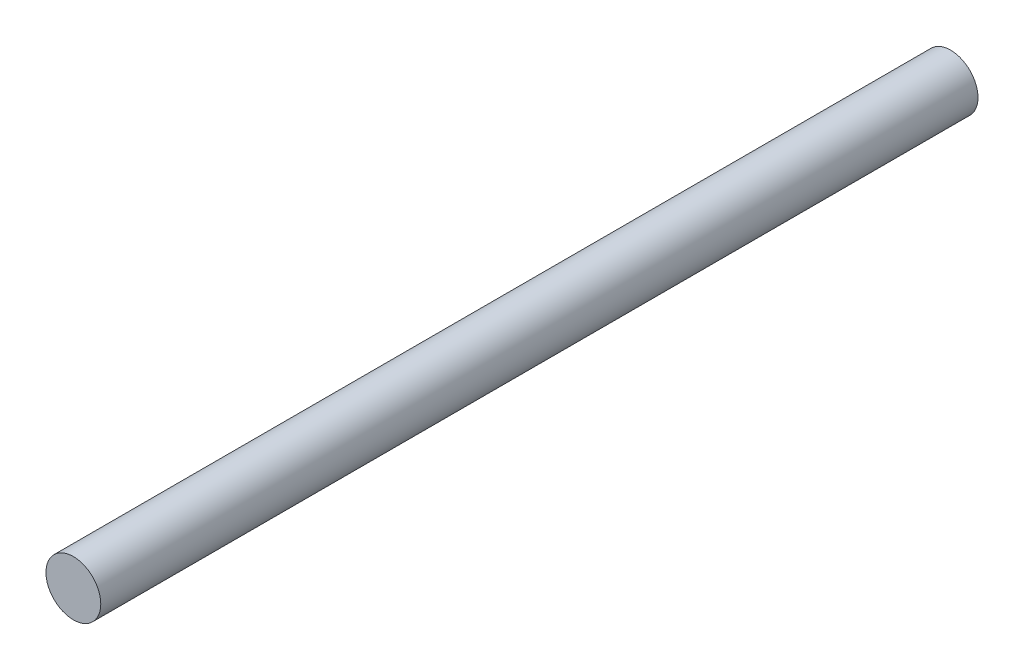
SolidWorks part; units mm, degrees
ref_plane "Plan de face" through (0, 0, 0) normal (0, 0, 1) x (1, 0, 0)
ref_plane "Plan de dessus" through (0, 0, 0) normal (0, 1, 0) x (1, 0, 0)
ref_plane "Plan de droite" through (0, 0, 0) normal (1, 0, 0) x (0, 0, -1)
sketch "Esquisse1" plane through (0, 0, 0) normal (0, 0, 1) x (1, 0, 0)
  circle A0 centre (0, 0) radius 0.5
  dimension "D1" = 1
extrude "Boss.-Extru.1" add sketch "Esquisse1" along normal blind 16
